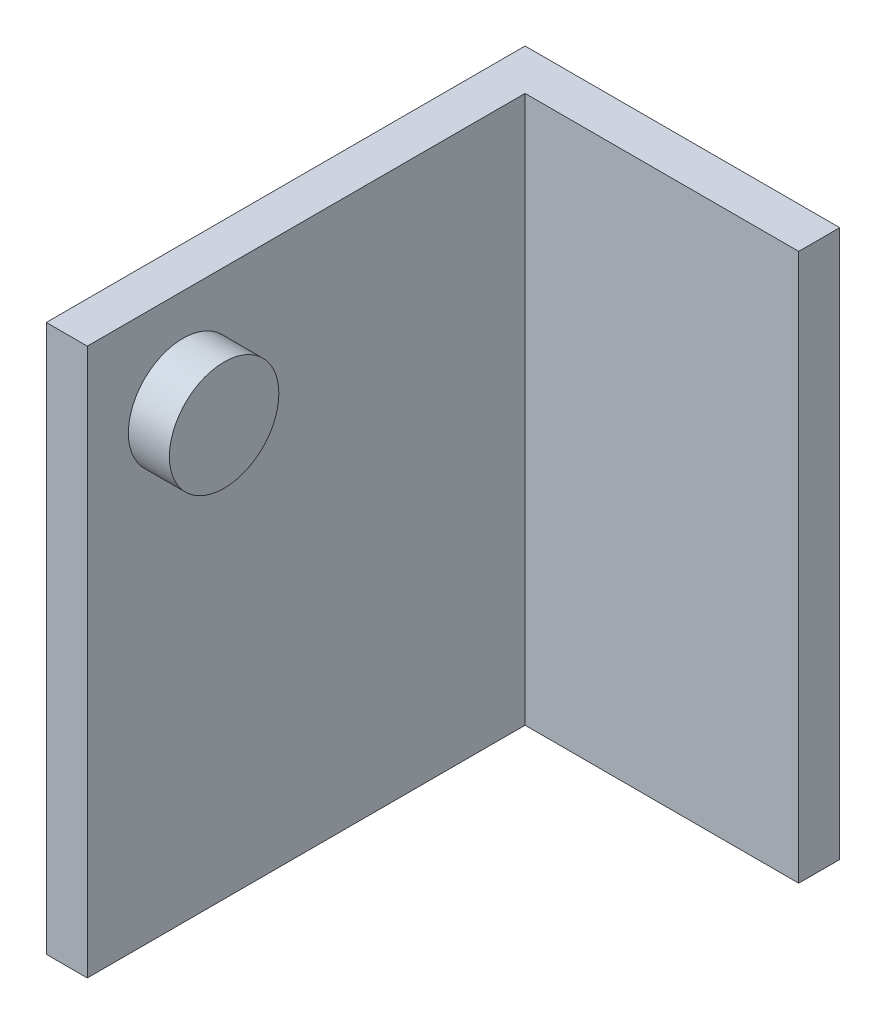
SolidWorks part; units mm, degrees
ref_plane "Front Plane" through (0, 0, 0) normal (0, 0, 1) x (1, 0, 0)
ref_plane "Top Plane" through (0, 0, 0) normal (0, 1, 0) x (1, 0, 0)
ref_plane "Right Plane" through (0, 0, 0) normal (1, 0, 0) x (0, 0, -1)
body saved out of another part "Stock-Grinder v2-1"
